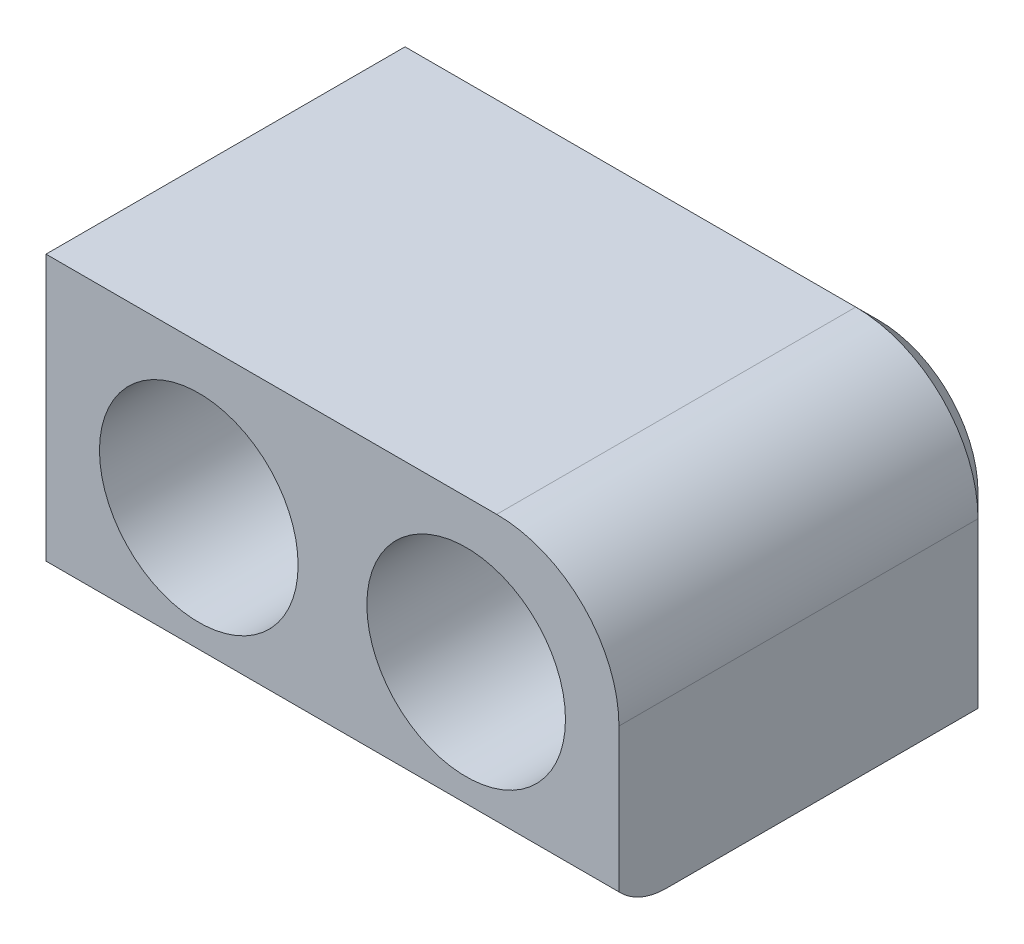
SolidWorks part; units mm, degrees
ref_plane "Front Plane" through (0, 0, 0) normal (0, 0, 1) x (1, 0, 0)
ref_plane "Top Plane" through (0, 0, 0) normal (0, 1, 0) x (1, 0, 0)
ref_plane "Right Plane" through (0, 0, 0) normal (1, 0, 0) x (0, 0, -1)
sketch "Sketch3" plane through (0, 0, 0) normal (0, 0, 1) x (1, 0, 0)
  line L0 (0, -5.2388) -> (0, 5.2388) construction
  line L1 (0, 9.525) -> (19.05, 9.525)
  line L2 (0, 9.525) -> (0, 0)
  line L3 (0, 0) -> (19.05, 0)
  line L4 (19.05, 9.525) -> (19.05, 0)
  dimension "D1" = 9.525
  dimension "D2" = 19.05
extrude "Extrude1" add sketch "Sketch3" against normal blind 12.7
fillet "Fillet1" radius 4.064 1 edges at (19.05, 9.525, -6.35)
hole_wizard "#6 CBORE" positions "Sketch7" profile "Sketch6" counterbore size "#6" standard "ANSI Inch"
sketch "Sketch7" plane through (0, 0, 0) normal (0, 0, 1) x (1, 0, 0)
  line L1 (-2.0915, 4.7625) -> (49997.9085, 4.7625) construction
  line L2 (14.986, 9.525) -> (0, 9.525) construction
  line L3 (0, 0) -> (19.05, 0) construction
  line L4 (0, 9.525) -> (0, 0) construction
  point P0 (5.08, 4.7625)
  point P1 (13.97, 4.7625)
  dimension "D1" = 5.08
  dimension "D2" = 13.97
sketch "Sketch6" plane through (5.08, 4.7625, 0) normal (1, 0, 0) x (0, -1, 0)
  line L0 (0, 0) -> (0, 12.7)
  line L1 (0, 12.7) -> (2.159, 12.7)
  line L3 (2.159, 12.7) -> (2.159, 4.826)
  line L4 (2.159, 4.826) -> (3.302, 4.826)
  line L5 (3.302, 4.826) -> (3.302, 0)
  line L7 (3.302, 0) -> (0, 0)
  line L11 (0, -6.35) -> (0, 107.95) construction
  dimension "Thru Hole Dia." = 4.318
  dimension "Thru Hole Depth" = 12.7
  dimension "C'Bore Dia." = 6.604
  dimension "C'Bore Depth" = 4.826
sketch "Sketch8" plane through (0, 0, 0) normal (-1, 0, 0) x (0, 0, 1)
  line L0 (0, 0.6851) -> (1.27, 0.6851)
  line L1 (1.27, 0.6851) -> (1.27, -1.8549)
  line L2 (-1.5748, -1.8549) -> (-1.5748, 0)
  line L3 (1.27, -1.8549) -> (-1.5748, -1.8549)
  line L4 (-12.7, 0) -> (0, 0) construction
  line L13 (-12.7, 0) -> (0, 0) construction
  line L14 (0, 9.525) -> (0, 0) construction
  arc A0 (-1.5748, 0) -> (0, 0.6851) centre (-1.5748, 2.1525) ccw
  dimension "D4" = 2.54
  dimension "D5" = 1.27
extrude "Cut-Extrude1" cut sketch "Sketch8" against normal through all
chamfer "Chamfer1" distance 0.762 angle 45 3 edges at (7.493, 9.525, -12.7) (19.05, 2.7305, -12.7) (17.8597, 8.3347, -12.7)
